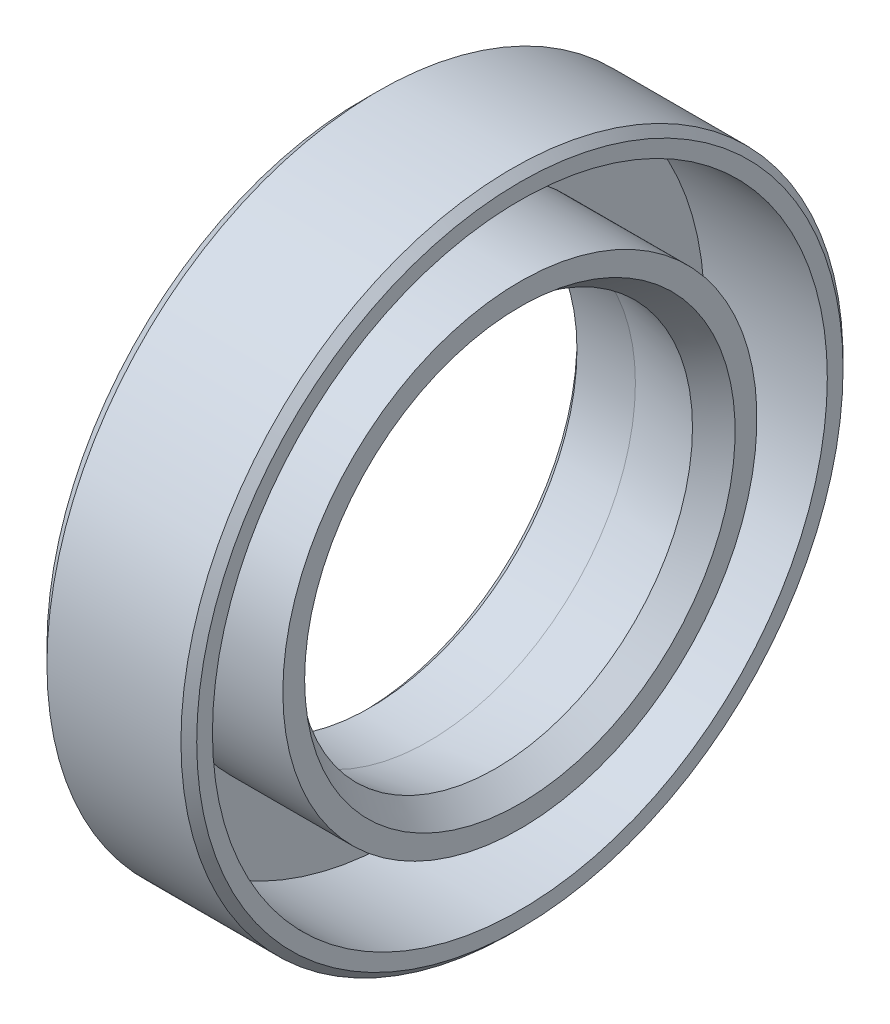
SolidWorks part; units mm, degrees
ref_plane "Front Plane" through (0, 0, 0) normal (0, 0, 1) x (1, 0, 0)
ref_plane "Top Plane" through (0, 0, 0) normal (0, 1, 0) x (1, 0, 0)
ref_plane "Right Plane" through (0, 0, 0) normal (1, 0, 0) x (0, 0, -1)
sketch "Sketch1" plane through (0, 0, 0) normal (0, 0, 1) x (1, 0, 0)
  line L0 (5, -1.7143) -> (5, -3.0952)
  line L1 (-4, 4.25) -> (4.5, 4.25)
  line L2 (-5, 3.25) -> (-5, -3.1283)
  line L3 (-4, 4.25) -> (-5, 3.25)
  line L4 (5, 3.75) -> (5, 2.7518)
  line L5 (4.5, 4.25) -> (5, 3.75)
  line L6 (-5, -3.1283) -> (-4.5, -3.6283)
  line L7 (5, 2.7518) -> (-2.8038, 2.7518)
  line L8 (-4.5, -3.6283) -> (-0.7941, -3.6283)
  line L9 (5, -1.7143) -> (-2.8038, -1.7143)
  line L10 (-2.8038, 2.7518) -> (-2.8038, -1.7143)
  line L11 (-0.7941, -3.6283) -> (3.4487, -4.25)
  line L12 (3.4487, -4.25) -> (5, -3.0952)
  point P0 (0, 0)
  point P2 (-5, 4.25)
  point P4 (5, 4.25)
  point P10 (-5, -3.6283)
  dimension "D1" = 10
ref_plane "Plane1" through (3.4487, 0, 0) normal (1, 0, 0) x (0, 0, -1)
sketch "Sketch2" plane through (3.4487, 0, 0) normal (1, 0, 0) x (0, 0, -1)
  circle A0 centre (0, -16.75) radius 12.5
  dimension "D1" = 25
sweep "Sweep1" add profiles "Sketch1" path "Sketch2"
